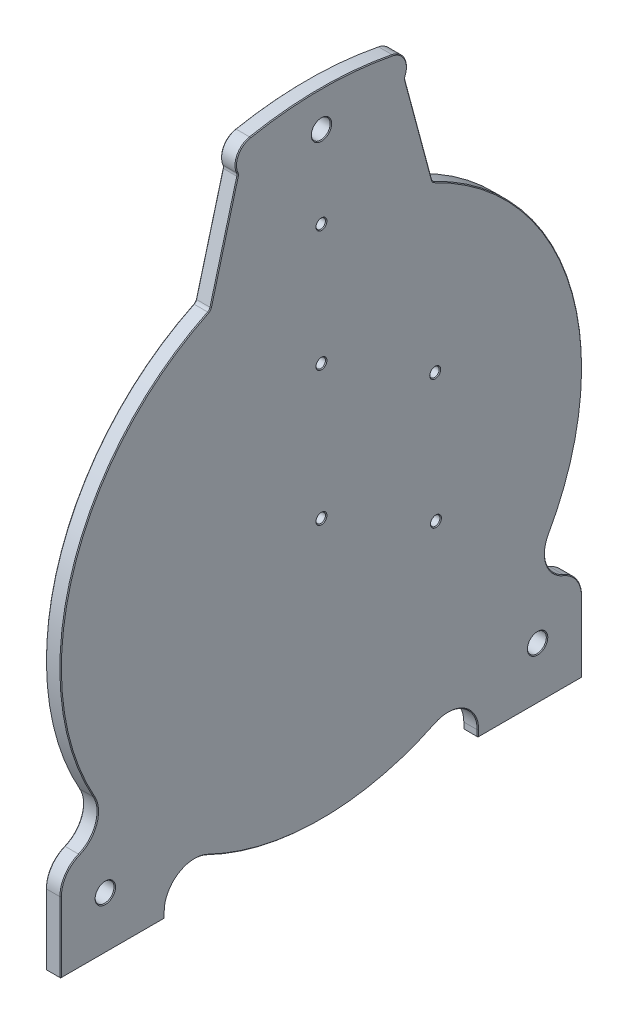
SolidWorks part; units mm, degrees
ref_plane "Спереди" through (0, 0, 0) normal (0, 0, 1) x (1, 0, 0)
ref_plane "Сверху" through (0, 0, 0) normal (0, 1, 0) x (1, 0, 0)
ref_plane "Справа" through (0, 0, 0) normal (1, 0, 0) x (0, 0, -1)
sketch "Эскиз1" plane through (0, 0, 0) normal (1, 0, 0) x (0, 0, -1)
  line L0 (0, 250) -> (0, -250) construction
  line L1 (-56.02, 227.8371) -> (-74.6591, 158.2752)
  line L2 (56.02, 227.8371) -> (74.6591, 158.2752)
  line L3 (-105, -180) -> (-175, -180)
  line L4 (-175, -180) -> (-175, -132.5)
  line L5 (0, 250) -> (-416.5081, 250) construction
  line L6 (-105, -180) -> (-105, -175.4993)
  line L7 (105, -180) -> (105, -175.4993)
  line L8 (105, -180) -> (175, -180)
  line L9 (175, -180) -> (175, -132.5)
  arc A0 (-74.6591, 158.2752) -> (-152.6076, -85.6501) centre (0, 0) ccw
  circle A1 centre (0, 0) radius 3.175
  circle A2 centre (0, 90) radius 3.175
  circle A3 centre (0, 171) radius 3.175
  circle A4 centre (0, 226) radius 6.35
  arc A5 (47.7941, 245.3889) -> (-47.7941, 245.3889) centre (0, 0) ccw
  arc A6 (-47.7941, 245.3889) -> (-56.02, 227.8371) centre (-45.5, 233.6103) ccw
  arc A7 (47.7941, 245.3889) -> (56.02, 227.8371) centre (45.5, 233.6103) cw
  circle A8 centre (76.32, 46.6153) radius 3.175
  circle A9 centre (76.81, -39.9973) radius 3.175
  circle A10 centre (0, 0) radius 86.6 construction
  circle A11 centre (0, 0) radius 89.43 construction
  arc A12 (-76.2821, -157.4994) -> (-105, -175.4993) centre (-85, -175.4993) ccw
  arc A13 (-76.2821, -157.4994) -> (76.2821, -157.4994) centre (0, 0) ccw
  circle A14 centre (-145, -145) radius 6.35
  arc A15 (-162.5242, -113.9693) -> (-175, -132.5) centre (-155, -132.5) ccw
  arc A16 (-162.5242, -113.9693) -> (-152.6076, -85.6501) centre (-170.0484, -95.4386) ccw
  arc A17 (76.2821, -157.4994) -> (105, -175.4993) centre (85, -175.4993) cw
  circle A18 centre (145, -145) radius 6.35
  arc A19 (162.5242, -113.9693) -> (175, -132.5) centre (155, -132.5) cw
  arc A20 (162.5242, -113.9693) -> (152.6076, -85.6501) centre (170.0484, -95.4386) cw
  arc A21 (152.6076, -85.6501) -> (74.6591, 158.2752) centre (0, 0) ccw
  dimension "D1" = 350
  dimension "D2" = 6.35
  dimension "D6" = 12.7
  dimension "D7" = 500
  dimension "D10" = 24
  dimension "D13" = 173.2
  dimension "D15" = 178.86
  dimension "D19" = 40
  dimension "D20" = 12.7
  dimension "D24" = 40
  dimension "D3" = 90
  dimension "D4" = 81
  dimension "D5" = 55
  dimension "D8" = 45.5
  dimension "D9" = 15
  dimension "D11" = 112.04
  dimension "D12" = 76.81
  dimension "D14" = 76.32
  dimension "D16" = 430
  dimension "D17" = 350
  dimension "D18" = 70
  dimension "D21" = 35
  dimension "D22" = 290
  dimension "D23" = 47.5
extrude "Бобышка-Вытянуть1" add sketch "Эскиз1" along normal blind 10
fillet "Скругление1" radius 3 4 edges at (5, 227.8371, -56.02) (5, 158.2752, -74.6591) (5, 227.8371, 56.02) (5, 158.2752, 74.6591)
chamfer "Фаска1" distance 0.5 angle 45 68 edges at (0, -145, -138.65) (0, -39.9973, -79.985) (0, 226, -6.35) (0, 90, -3.175) (0, 0, -3.175) (0, 171, -3.175) (0, 46.6153, -79.495) (0, -145, 138.65) (10, -145, -138.65) (10, -39.9973, -79.985) (10, 226, -6.35) (10, 90, -3.175) (5, -180, -105) (5, -180, -175) (5, -180, 175) (0, 250, 0) (0, 239.155, 56.1422) (0, 193.1796, 65.3064) (0, 52.6152, 166.9031) (0, -102.0486, 151.1723) (0, -121.3305, 171.5904) (0, -156.25, 175) (0, -180, 140) (0, 239.155, -56.1422) (0, 193.1796, -65.3064) (0, 52.6152, -166.9031) (0, -102.0486, -151.1723) (0, -121.3305, -171.5904) (0, -156.25, -175) (0, -180, -140) (0, -177.7496, -105) (0, -158.5529, -95.6217) (0, -175, 0) (0, -158.5529, 95.6217) (0, -177.7496, 105) (5, -180, 105) (10, 193.1796, -65.3064) (10, 52.6152, -166.9031) (10, -102.0486, -151.1723) (10, -121.3305, -171.5904) (10, -156.25, -175) (10, -180, -140) (10, -177.7496, -105) (10, -158.5529, -95.6217) (10, -175, 0) (10, -158.5529, 95.6217) (10, -177.7496, 105) (10, -180, 140) (10, -156.25, 175) (10, -121.3305, 171.5904) (10, -102.0486, 151.1723) (10, 52.6152, 166.9031) (10, 193.1796, 65.3064) (10, 239.155, 56.1422) (10, 250, 0) (10, 239.155, -56.1422) (10, 0, -3.175) (10, 171, -3.175) (10, 46.6153, -79.495) (10, -145, 138.65) (0, 227.7577, 56.2189) (0, 158.4739, 74.8888) (0, 227.7577, -56.2189) (0, 158.4739, -74.8888) (10, 158.4739, -74.8888) (10, 158.4739, 74.8888) (10, 227.7577, 56.2189) (10, 227.7577, -56.2189)
